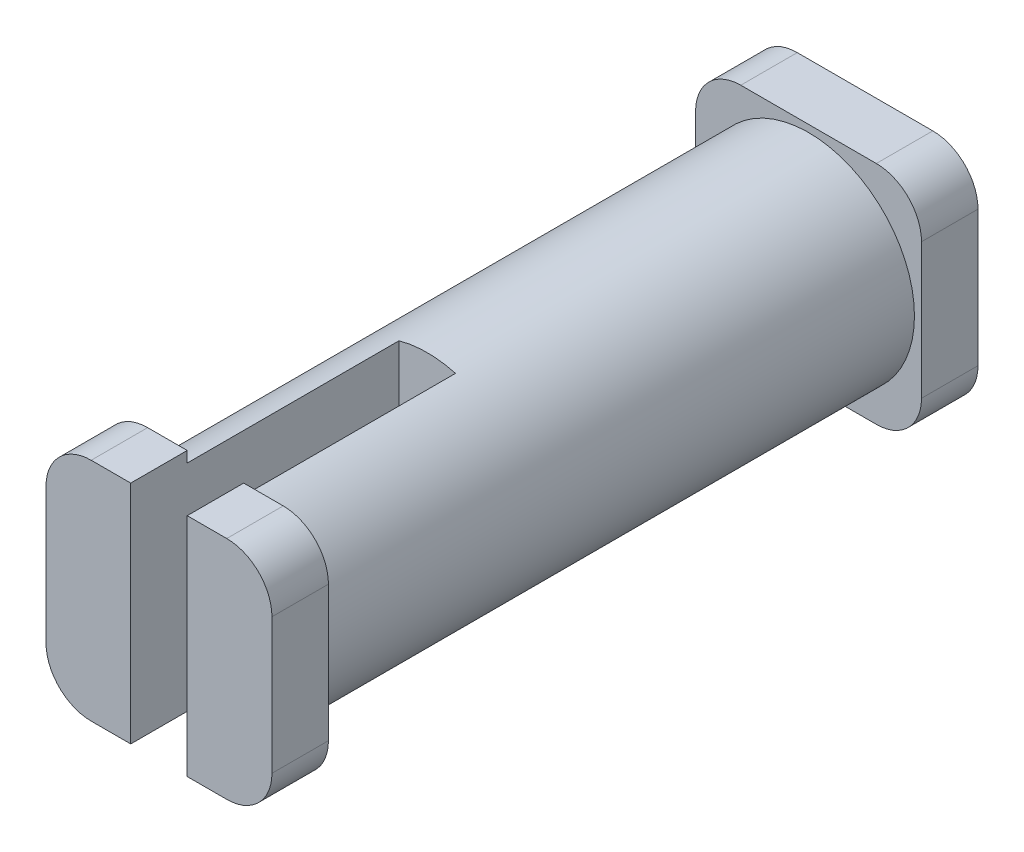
SolidWorks part; units mm, degrees
ref_plane "Front Plane" through (0, 0, 0) normal (0, 0, 1) x (1, 0, 0)
ref_plane "Top Plane" through (0, 0, 0) normal (0, 1, 0) x (1, 0, 0)
ref_plane "Right Plane" through (0, 0, 0) normal (1, 0, 0) x (0, 0, -1)
sketch "Sketch1" plane through (0, 0, 0) normal (0, 0, 1) x (1, 0, 0)
  line L1 (1.27, 0) -> (5.08, 0)
  line L2 (0, 1.27) -> (0, 5.08)
  line L3 (1.27, 6.35) -> (5.08, 6.35)
  line L4 (6.35, 1.27) -> (6.35, 5.08)
  arc A0 (5.08, 0) -> (6.35, 1.27) centre (5.08, 1.27) ccw
  arc A1 (1.27, 0) -> (0, 1.27) centre (1.27, 1.27) cw
  arc A2 (0, 5.08) -> (1.27, 6.35) centre (1.27, 5.08) cw
  arc A3 (5.08, 6.35) -> (6.35, 5.08) centre (5.08, 5.08) cw
  point P7 (6.35, 0)
  point P10 (0, 0)
  point P13 (0, 6.35)
  point P16 (6.35, 6.35)
  dimension "D3" = 1.27
  dimension "D1" = 6.35
  dimension "D2" = 6.35
extrude "Boss-Extrude1" add sketch "Sketch1" along normal blind 1.5875
sketch "Sketch2" plane through (0, 0, 1.5875) normal (0, 0, 1) x (1, 0, 0)
  line L0 (0, 5.08) -> (0, 1.27) construction
  line L1 (5.08, 6.35) -> (1.27, 6.35) construction
  circle A0 centre (3.175, 3.175) radius 2.9766
  point P5 (0, 3.175)
  point P9 (3.175, 6.35)
  dimension "D1" = 5.9531
extrude "Boss-Extrude2" add sketch "Sketch2" along normal blind 16.6687
ref_plane "Plane1" through (0, 0, 9.9219) normal (0, 0, 1) x (1, 0, 0)
mirror "Mirror1" about plane through (0, 0, 9.9219) normal (0, 0, 1) of "Boss-Extrude1"
sketch "Sketch3" plane through (0, 0, 19.8437) normal (0, 0, 1) x (1, 0, 0)
  line L0 (5.08, 6.35) -> (1.27, 6.35) construction
  line L1 (2.3813, 6.35) -> (3.9688, 6.35)
  line L2 (2.3813, 6.35) -> (2.3813, 0)
  line L3 (2.3813, 0) -> (3.9688, 0)
  line L4 (3.9688, 6.35) -> (3.9688, 0)
  line L5 (1.27, 0) -> (5.08, 0) construction
  line L6 (3.175, 0) -> (3.175, -0.924) construction
  point P12 (3.175, 0)
  dimension "D1" = 1.5875
extrude "Cut-Extrude1" cut sketch "Sketch3" against normal blind 7.5406
